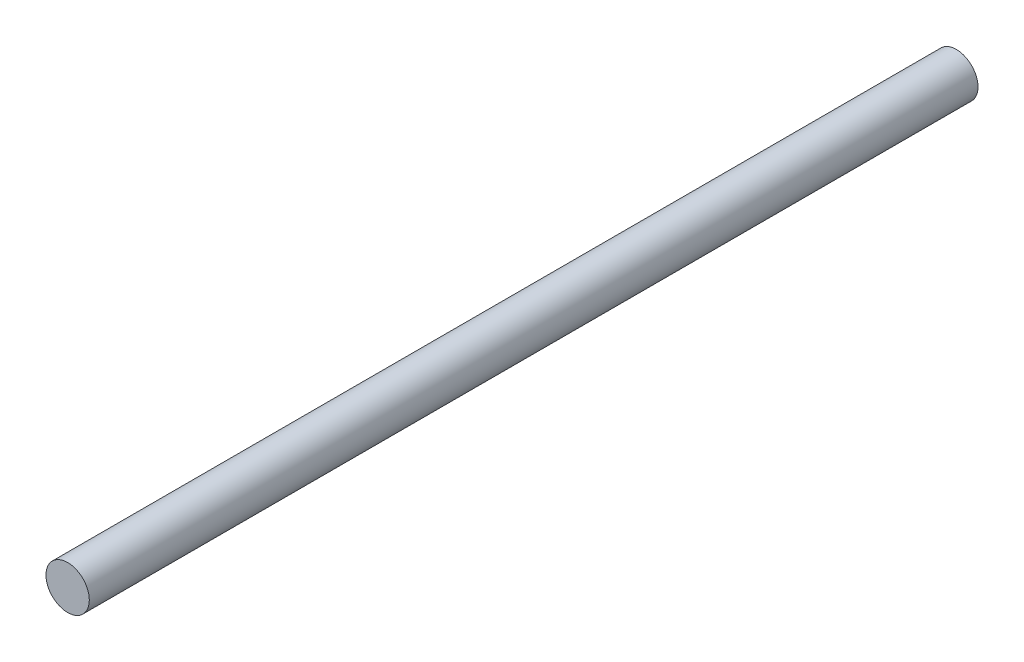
SolidWorks part; units mm, degrees
ref_plane "Front" through (0, 0, 0) normal (0, 0, 1) x (1, 0, 0)
ref_plane "Top" through (0, 0, 0) normal (0, 1, 0) x (1, 0, 0)
ref_plane "Right" through (0, 0, 0) normal (1, 0, 0) x (0, 0, -1)
sketch "Sketch1" plane through (0, 0, 0) normal (0, 0, 1) x (1, 0, 0)
  circle A0 centre (0, 0) radius 6.35
  dimension "D1" = 12.7
extrude "Extrude1" add sketch "Sketch1" along normal mid plane 260.35
